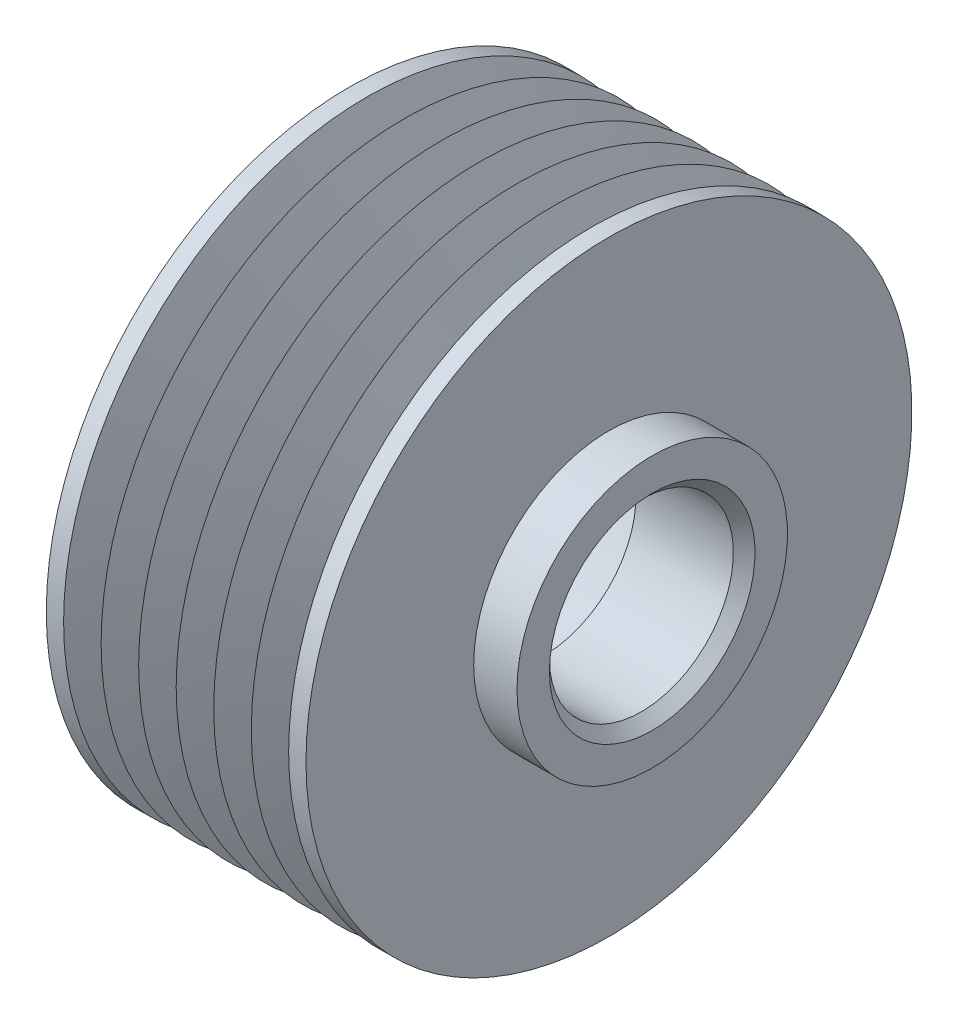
SolidWorks part; units mm, degrees
ref_plane "Face" through (0, 0, 0) normal (0, 0, 1) x (1, 0, 0)
ref_plane "Dessus" through (0, 0, 0) normal (0, 1, 0) x (1, 0, 0)
ref_plane "Droite" through (0, 0, 0) normal (1, 0, 0) x (0, 0, -1)
sketch "Esquisse1" plane through (0, 0, 0) normal (0, 0, 1) x (1, 0, 0)
  line L0 (-10, 0) -> (84, 0) construction
  line L1 (0, 20) -> (0, 28)
  line L2 (0, 28) -> (1.6, 28)
  line L3 (1.6, 28) -> (3.3011, 23.5)
  line L4 (3.3011, 23.5) -> (5.0667, 28)
  line L5 (5.0667, 28) -> (6.7711, 23.5)
  line L6 (6.7711, 23.5) -> (8.5367, 28)
  line L7 (8.5367, 28) -> (10.2411, 23.5)
  line L8 (10.2411, 23.5) -> (12.0067, 28)
  line L9 (12.0067, 28) -> (13.7111, 23.5)
  line L10 (13.7111, 23.5) -> (15.4767, 28)
  line L11 (15.4767, 28) -> (17.1811, 23.5)
  line L12 (17.1811, 23.5) -> (18.9467, 28)
  line L13 (18.9467, 28) -> (20.8911, 23.5)
  line L14 (20.8911, 23.5) -> (22.4, 28)
  line L15 (22.4, 28) -> (24, 28)
  line L16 (24, 28) -> (24, 12.5)
  line L17 (24, 12.5) -> (28, 12.5)
  line L18 (28, 12.5) -> (28, 8.5)
  line L19 (28, 8.5) -> (18, 8.5)
  line L20 (18, 8.5) -> (18, 15)
  line L21 (18, 15) -> (15, 18)
  line L22 (15, 18) -> (2, 18)
  line L23 (2, 18) -> (0, 20)
  dimension "D1" = 56
  dimension "D2" = 17
  dimension "D3" = 25
  dimension "D4" = 4
  dimension "D5" = 24
  dimension "D6" = 1.6
  dimension "D7" = 1.6
  dimension "D8" = 36
  dimension "D9" = 18
  dimension "D10" = 40
  dimension "D11" = 45
  dimension "D12" = 47
  dimension "D13" = 3.4667
  dimension "D14" = 3.47
  dimension "D15" = 3.47
  dimension "D16" = 3.47
  dimension "D17" = 3.47
  dimension "D18" = 3.47
  dimension "D19" = 3.47
  dimension "D20" = 3.47
  dimension "D21" = 3.71
  dimension "D22" = 3.47
  dimension "D23" = 3.4533
  dimension "D24" = 45
  dimension "D25" = 15
  dimension "D26" = 47
  dimension "D27" = 47
  dimension "D28" = 47
  dimension "D29" = 47
  dimension "D30" = 47
  dimension "D31" = 56
  dimension "D32" = 56
  dimension "D33" = 56
  dimension "D34" = 56
  dimension "D35" = 3.3011
revolve "Base-Révolution" add sketch "Esquisse1" angle 360 about L0
chamfer "Chanfrein1" distance 1 angle 45 1 edges at (28, 0, 8.5)
